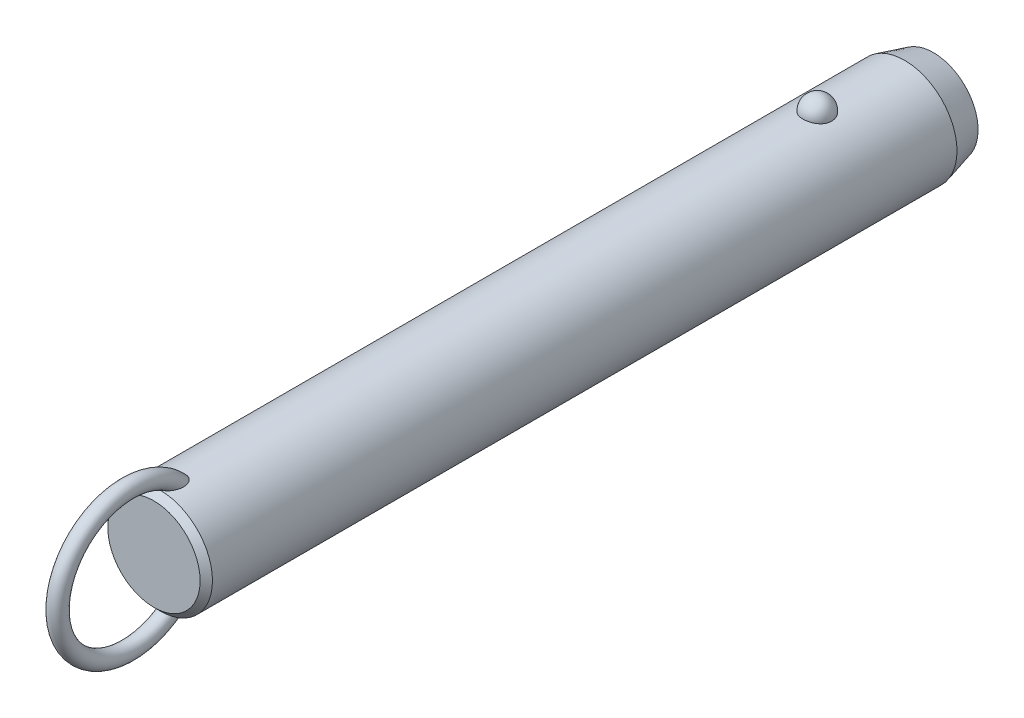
SolidWorks part; units mm, degrees
ref_plane "Front Plane" through (0, 0, 0) normal (0, 0, 1) x (1, 0, 0)
ref_plane "Top Plane" through (0, 0, 0) normal (0, 1, 0) x (1, 0, 0)
ref_plane "Right Plane" through (0, 0, 0) normal (1, 0, 0) x (0, 0, -1)
sketch "Sketch2" plane through (0, 0, 0) normal (0, 0, 1) x (1, 0, 0)
  circle A0 centre (0, 0) radius 12.7
  point P3 (0, 12.7)
  dimension "D1" = 25.4
extrude "Boss-Extrude1" add sketch "Sketch2" along normal blind 144.8
sketch "Sketch3" plane through (0, 0, 0) normal (0, 0, -1) x (-1, 0, 0)
  circle A0 centre (0, 0) radius 12.7
  dimension "D1" = 25.4
extrude "Boss-Extrude2" add sketch "Sketch3" along normal blind 31.7
chamfer "Chamfer1" distance 7 angle 15 1 edges at (-12.7, 0, -31.7)
sketch "Sketch12" plane through (0, 0, 0) normal (1, 0, 0) x (0, 0, -1)
  line L0 (-144.8, 12.7) -> (-144.8, -12.7) construction
  point P0 (-144.8, 0)
sketch "Sketch13" plane through (0, 0, 0) normal (1, 0, 0) x (0, 0, -1)
  circle A0 centre (-163.85, 0) radius 19.05
  point P2 (-144.8, 0)
  dimension "D1" = 38.1
sketch "Sketch14" plane through (0, 0, 0) normal (0, 1, 0) x (1, 0, 0)
  circle A0 centre (0, -146.8) radius 2
  point P2 (0, -144.8)
  dimension "D1" = 4
sweep "Sweep1" add profiles "Sketch14" path "Sketch13"
sketch "Sketch15" plane through (0, 0, 144.8) normal (0, 0, 1) x (1, 0, 0)
  circle A0 centre (0, 0) radius 12.7
  dimension "D1" = 25.4
extrude "Boss-Extrude3" add sketch "Sketch15" along normal blind 12.7
chamfer "Chamfer2" distance 1.5 angle 45 1 edges at (12.7, 0, 157.5)
sketch "Sketch18" plane through (0, 0, 0) normal (1, 0, 0) x (0, 0, -1)
  line L0 (24.7, 12.7) -> (-149.651, 12.7) construction
  line L1 (3.5, 16.2) -> (3.5, 9.2)
  line L2 (-149.651, -12.7) -> (24.7, -12.7) construction
  arc A0 (3.5, 16.2) -> (3.5, 9.2) centre (3.5, 12.7) ccw
  point P4 (0, 12.7)
  dimension "D1" = 28.9
revolve "Revolve1" add sketch "Sketch18" angle 360 about L1
